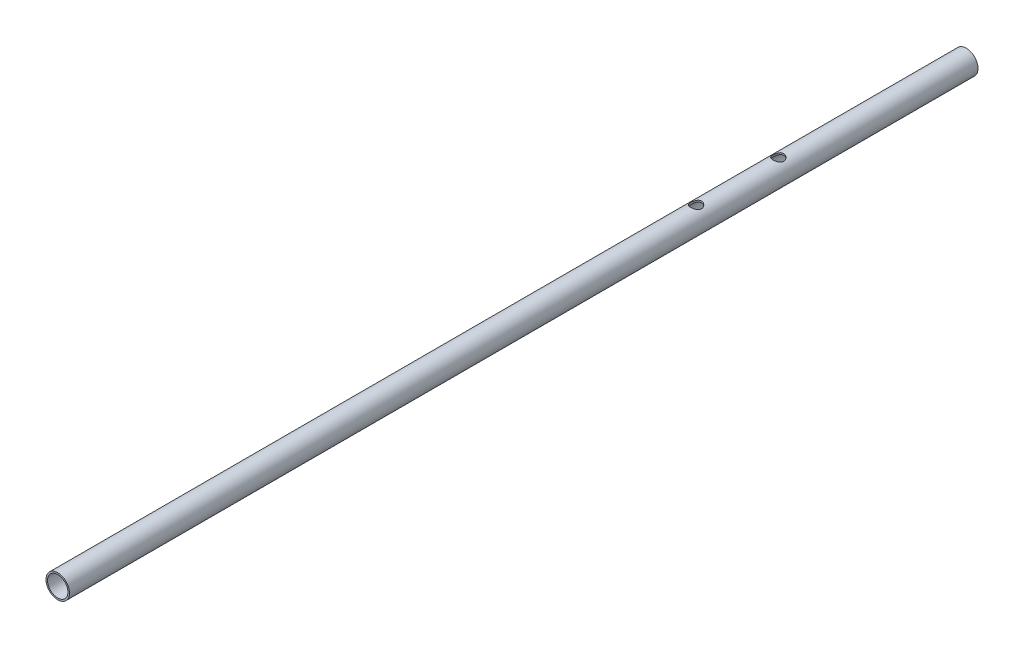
SolidWorks part; units mm, degrees
ref_plane "Face" through (0, 0, 0) normal (0, 0, 1) x (1, 0, 0)
ref_plane "Dessus" through (0, 0, 0) normal (0, 1, 0) x (1, 0, 0)
ref_plane "Droite" through (0, 0, 0) normal (1, 0, 0) x (0, 0, -1)
sketch "Esquisse1" plane through (0, 0, 0) normal (0, 0, 1) x (1, 0, 0)
  circle A0 centre (0, 0) radius 15
  circle A1 centre (0, 0) radius 13
  dimension "D1" = 30
  dimension "D2" = 26
extrude "Extrusion1" add sketch "Esquisse1" along normal blind 1160
sketch "Esquisse2" plane through (0, 0, 0) normal (0, 1, 0) x (1, 0, 0)
  line L0 (0, -1160) -> (0, 0) construction
  circle A0 centre (0, -240) radius 7
  circle A1 centre (0, -345) radius 7
  dimension "D1" = 14
  dimension "D2" = 240
  dimension "D3" = 105
extrude "Enlèv. mat.-Extru.1" cut sketch "Esquisse2" along normal blind 40
sketch "Esquisse3" plane through (0, 0, 0) normal (0, 1, 0) x (1, 0, 0)
  line L0 (0, -1160) -> (0, 0) construction
  circle A0 centre (0, -240) radius 4.25
  circle A1 centre (0, -345) radius 4.25
  circle A2 centre (0, -240) radius 7 construction
  circle A3 centre (0, -345) radius 7 construction
  dimension "D1" = 8.5
extrude "Enlèv. mat.-Extru.2" cut sketch "Esquisse3" against normal blind 40
